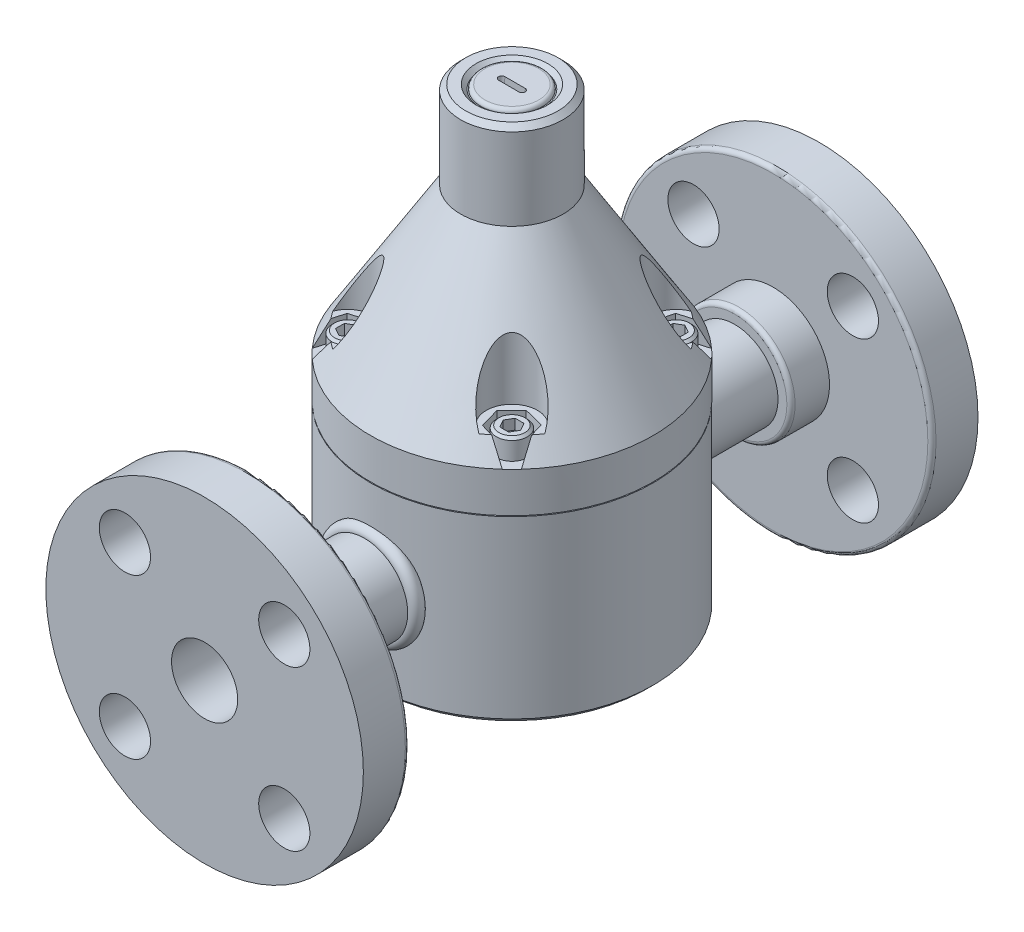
SolidWorks part; units mm, degrees
ref_plane "Front Plane" through (0, 0, 0) normal (0, 0, 1) x (1, 0, 0)
ref_plane "Top Plane" through (0, 0, 0) normal (0, 1, 0) x (1, 0, 0)
ref_plane "Right Plane" through (0, 0, 0) normal (1, 0, 0) x (0, 0, -1)
sketch "Sketch1" plane through (0, 0, 0) normal (0, 1, 0) x (1, 0, 0)
  circle A0 centre (0, 0) radius 43.815
  dimension "D1" = 87.63
extrude "Extrude1" add sketch "Sketch1" along normal blind 140.97
sketch "Sketch2" plane through (0, 0, 0) normal (0, 0, 1) x (1, 0, 0)
  line L0 (0, 0) -> (0, 140.97) construction
  line L1 (43.815, 140.97) -> (-43.815, 140.97) construction
  line L2 (-43.815, 56.134) -> (-43.815, 68.58)
  line L3 (-43.815, 56.134) -> (-30.226, 56.134)
  line L4 (-30.226, 56.134) -> (-30.226, 55.88)
  line L6 (-30.226, 55.88) -> (-49.4473, 55.88)
  line L7 (-49.4473, 55.88) -> (-49.4473, 147.034)
  line L8 (-49.4473, 147.034) -> (-15.875, 147.034)
  line L9 (-15.875, 147.034) -> (-15.875, 114.046)
  line L10 (-15.875, 114.046) -> (-43.815, 68.58)
  line L12 (-43.815, 0) -> (43.815, 0) construction
  dimension "D1" = 43.815
  dimension "D2" = 55.88
  dimension "D3" = 0.254
  dimension "D4" = 30.226
  dimension "D5" = 15.875
  dimension "D6" = 68.58
  dimension "D7" = 26.924
revolve "Cut-Revolve1" cut sketch "Sketch2" angle 360 about L0
ref_plane "Plane1" through (0, 140.97, 0) normal (0, 1, 0) x (-1, 0, 0)
sketch "Sketch3" plane through (0, 140.97, 0) normal (0, 1, 0) x (-1, 0, 0)
  circle A0 centre (0, 0) radius 11.1125
  dimension "D1" = 22.225
extrude "Extrude2" cut sketch "Sketch3" against normal blind 1.27 draft 45
chamfer "Chamfer1" distance 1.5748 angle 45 2 edges at (0, 0, 43.815) (0, 140.97, 15.875)
sketch "Sketch4" plane through (0, 140.97, 0) normal (0, 1, 0) x (-1, 0, 0)
  circle A0 centre (0, 0) radius 9.525
  dimension "D1" = 19.05
extrude "Extrude3" add sketch "Sketch4" against normal up to surface (1.27 mm away)
fillet "Fillet1" radius 1.143 1 edges at (0, 140.97, 9.525)
sketch "Sketch5" plane through (0, 140.97, 0) normal (0, 1, 0) x (-1, 0, 0)
  line L0 (-3.175, 0) -> (3.175, 0) construction
  line L1 (3.175, 0.9652) -> (-3.175, 0.9652)
  line L2 (-3.175, -0.9652) -> (3.175, -0.9652)
  arc A0 (-3.175, 0.9652) -> (-3.175, -0.9652) centre (-3.175, 0) ccw
  arc A1 (3.175, -0.9652) -> (3.175, 0.9652) centre (3.175, 0) ccw
  dimension "D1" = 3.175
  dimension "D2" = 6.35
  dimension "D3" = 0.9652
  dimension "D4" = 0.9652
extrude "Extrude4" cut sketch "Sketch5" against normal blind 3.302 draft 1
ref_plane "Plane2" through (0, 74.93, 0) normal (0, 1, 0) x (-1, 0, 0)
sketch "Sketch6" plane through (0, 74.93, 0) normal (0, 1, 0) x (-1, 0, 0)
  line L0 (0, 0) -> (-43.815, 0) construction
  line L1 (0, 0) -> (-30.9819, 30.9819) construction
  circle A0 centre (0, 0) radius 43.815 construction
  circle A1 centre (0, 0) radius 36.0045 construction
  circle A2 centre (-25.459, 25.459) radius 7.9375
  dimension "D1" = 72.009
  dimension "D2" = 15.875
extrude "Extrude5" cut sketch "Sketch6" along normal blind 22.86
sketch "Sketch8" plane through (0, 74.93, 0) normal (0, 1, 0) x (-1, 0, 0)
  line L0 (0, 0) -> (-30.9819, 30.9819) construction
  line L1 (-30.9819, 19.758) -> (-19.9362, 31.1601) construction
  line L2 (-30.9819, 30.9819) -> (-39.3973, 39.3973) construction
  line L3 (-29.9486, 20.8246) -> (-23.6903, 19.2537)
  line L4 (-23.6903, 19.2537) -> (-19.2007, 23.8882)
  line L5 (-19.2007, 23.8882) -> (-20.9694, 30.0935)
  line L9 (-29.9486, 20.8246) -> (-33.5917, 33.5917)
  line L10 (-33.5917, 33.5917) -> (-20.9694, 30.0935)
  line L12 (-27.2278, 31.6643) -> (-31.7174, 27.0299)
  line L13 (-20.9694, 30.0935) -> (-27.2278, 31.6643)
  line L14 (-31.7174, 27.0299) -> (-29.9486, 20.8246)
  circle A0 centre (0, 0) radius 43.815 construction
  arc A1 (-32.876, 22.6318) -> (-22.6318, 32.876) centre (-25.459, 25.459) ccw construction
  arc A2 (-32.876, 22.6318) -> (-22.6318, 32.876) centre (-25.459, 25.459) ccw construction
  circle A3 centre (-25.459, 25.459) radius 5.588 construction
extrude "Extrude6" cut sketch "Sketch8" against normal blind 6.35
pattern_circular "CirPattern1" count 4 over 360 about axis through (0, 0, 0) along (0, 1, 0) of "Extrude5", "Extrude6"
sketch "Sketch9" plane through (0, 74.93, 0) normal (0, 1, 0) x (-1, 0, 0)
  line L0 (0, 0) -> (-25.459, 25.459) construction
  circle A0 centre (-25.459, 25.459) radius 4.7625
  dimension "D1" = 9.525
extrude "Extrude7" add sketch "Sketch9" against normal up to surface (6.35 mm away)
sketch "Sketch10" plane through (0, 74.93, 0) normal (0, 1, 0) x (-1, 0, 0)
  line L1 (-28.1871, 25.459) -> (-26.8231, 23.0964)
  line L2 (-26.8231, 23.0964) -> (-24.095, 23.0964)
  line L3 (-24.095, 23.0964) -> (-22.7309, 25.459)
  line L4 (-22.7309, 25.459) -> (-24.095, 27.8216)
  line L5 (-24.095, 27.8216) -> (-26.8231, 27.8216)
  line L6 (-26.8231, 27.8216) -> (-28.1871, 25.459)
  circle A0 centre (-25.459, 25.459) radius 2.3626 construction
extrude "Extrude8" cut sketch "Sketch10" against normal blind 3.175
pattern_circular "CirPattern2" count 4 over 360 about axis through (0, 0, 0) along (0, 1, 0) of "Extrude7", "Extrude8"
chamfer "Chamfer2" distance 0.762 angle 45 4 edges at (-25.459, 74.93, -30.2215) (30.2215, 74.93, -25.459) (25.459, 74.93, 30.2215) (-30.2215, 74.93, 25.459)
ref_plane "Plane3" through (0, 0, 95.25) normal (0, 0, 1) x (1, 0, 0)
sketch "Sketch11" plane through (0, 0, 95.25) normal (0, 0, 1) x (1, 0, 0)
  line L0 (0, 0) -> (0, 140.97) construction
  line L1 (14.3002, 140.97) -> (-14.3002, 140.97) construction
  line L2 (-43.815, 28.575) -> (43.815, 28.575) construction
  line L3 (-43.815, 55.88) -> (-43.815, 1.5748) construction
  line L4 (43.815, 1.5748) -> (43.815, 55.88) construction
  line L5 (-42.2402, 0) -> (42.2402, 0) construction
  circle A0 centre (0, 28.575) radius 49.2125
  dimension "D2" = 98.425
  dimension "D1" = 28.575
extrude "Boss-Extrude1" add sketch "Sketch11" against normal blind 14.2748 separate body
sketch "Sketch12" plane through (0, 0, 95.25) normal (0, 0, 1) x (1, 0, 0)
  circle A0 centre (0, 28.575) radius 17.4625
  dimension "D1" = 34.925
extrude "Boss-Extrude2" add sketch "Sketch12" against normal blind 26.2128
sketch "Sketch13" plane through (0, 0, 95.25) normal (0, 0, 1) x (1, 0, 0)
  circle A0 centre (0, 28.575) radius 13.4366
  dimension "D1" = 26.8732
extrude "Boss-Extrude3" add sketch "Sketch13" against normal up to surface (53.5461 mm away)
sketch "Sketch14" plane through (0, 0, 95.25) normal (0, 0, 1) x (1, 0, 0)
  circle A0 centre (0, 28.575) radius 10.2616
  dimension "D1" = 20.5232
extrude "Cut-Extrude1" cut sketch "Sketch14" against normal blind 25.4
sketch "Sketch15" plane through (0, 0, 95.25) normal (0, 0, 1) x (1, 0, 0)
  line L0 (0, 28.575) -> (-49.2125, 28.575) construction
  line L1 (0, 28.575) -> (-34.7985, 63.3735) construction
  circle A0 centre (0, 28.575) radius 49.2125 construction
  circle A1 centre (0, 28.575) radius 34.925 construction
  circle A2 centre (-24.6957, 53.2707) radius 7.9375
  dimension "D2" = 69.85
  dimension "D3" = 15.875
  dimension "D1" = 45
extrude "Cut-Extrude2" cut sketch "Sketch15" against normal blind 25.4
pattern_circular "CirPattern3" count 4 over 360 about axis through (0, 28.575, 0) along (0, 0, 1) of "Cut-Extrude2"
sketch "Sketch16" plane through (0, 0, 0) normal (1, 0, 0) x (0, 0, -1)
  line L0 (-41.2557, 38.1023) -> (-45.7371, 38.1023)
  line L1 (-45.7371, 38.1023) -> (-45.7371, 42.0116)
  line L2 (-43.815, 42.0116) -> (-69.0372, 42.0116) construction
  line L3 (-41.2557, 38.1023) -> (-41.2557, 42.4601)
  line L4 (-95.25, 28.575) -> (0, 28.575) construction
  line L5 (-95.25, 77.7875) -> (-95.25, -20.6375) construction
  arc A0 (-45.7371, 42.0116) -> (-41.2557, 42.4601) centre (-43.4739, 42.0116) cw
revolve "Revolve1" add sketch "Sketch16" angle 360 about L4
ref_plane "Plane4" through (0, 0, -95.25) normal (0, 0, 1) x (1, 0, 0)
sketch "Sketch18" plane through (0, 0, -95.25) normal (0, 0, 1) x (1, 0, 0)
  circle A0 centre (0, 28.575) radius 49.2125
  dimension "D1" = 98.425
extrude "Boss-Extrude5" add sketch "Sketch18" along normal blind 14.2748 separate body
sketch "Sketch19" plane through (0, 0, -95.25) normal (0, 0, 1) x (1, 0, 0)
  circle A0 centre (0, 28.575) radius 17.4625
  dimension "D1" = 34.925
extrude "Boss-Extrude6" add sketch "Sketch19" along normal blind 26.2128
sketch "Sketch20" plane through (0, 0, -95.25) normal (0, 0, 1) x (1, 0, 0)
  circle A0 centre (0, 28.575) radius 13.4366
  dimension "D1" = 26.8732
extrude "Boss-Extrude7" add sketch "Sketch20" along normal up to surface (53.5461 mm away)
sketch "Sketch21" plane through (0, 0, -95.25) normal (0, 0, 1) x (1, 0, 0)
  circle A0 centre (0, 28.575) radius 10.2616
  dimension "D1" = 20.5232
extrude "Cut-Extrude3" cut sketch "Sketch21" along normal blind 25.4
sketch "Sketch22" plane through (0, 0, -95.25) normal (0, 0, 1) x (1, 0, 0)
  circle A0 centre (24.6957, 53.2707) radius 7.9375
extrude "Cut-Extrude4" cut sketch "Sketch22" along normal blind 25.4
pattern_circular "CirPattern4" count 4 over 360 about axis through (0, 28.575, 0) along (0, 0, 1) of "Cut-Extrude4"
fillet "Fillet3" radius 1.27 4 edges at (49.2125, 28.575, -80.9752) (17.4625, 28.575, -69.0372) (17.4625, 28.575, 69.0372) (49.2125, 28.575, 80.9752)
mirror "Mirror1" about plane through (0, 0, 0) normal (0, 0, 1) of "Revolve1"
